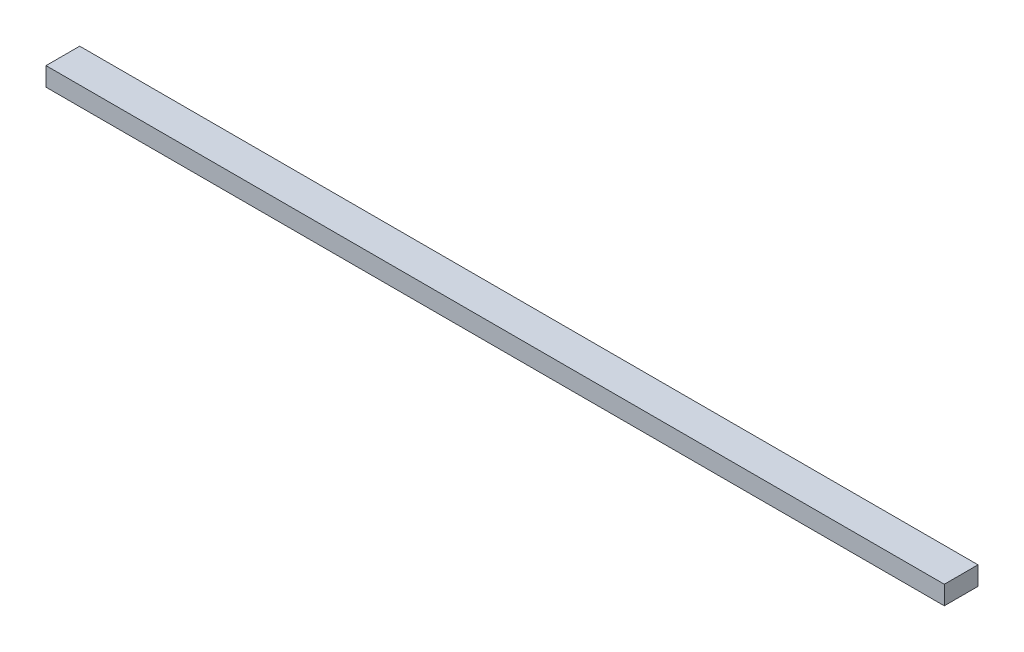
SolidWorks part; units mm, degrees
ref_plane "Front Plane" through (0, 0, 0) normal (0, 0, 1) x (1, 0, 0)
ref_plane "Top Plane" through (0, 0, 0) normal (0, 1, 0) x (1, 0, 0)
ref_plane "Right Plane" through (0, 0, 0) normal (1, 0, 0) x (0, 0, -1)
sketch "Sketch1" plane through (0, 0, 0) normal (0, 1, 0) x (1, 0, 0)
  line L1 (-304.8, -11.43) -> (304.8, -11.43)
  line L2 (-304.8, -11.43) -> (-304.8, 11.43)
  line L3 (-304.8, 11.43) -> (304.8, 11.43)
  line L4 (304.8, -11.43) -> (304.8, 11.43)
  line L5 (-304.8, -11.43) -> (304.8, 11.43) construction
  line L6 (-304.8, 11.43) -> (304.8, -11.43) construction
  point P0 (0, 0)
  dimension "D1" = 22.86
  dimension "D2" = 609.6
extrude "Boss-Extrude1" add sketch "Sketch1" along normal blind 12.7
